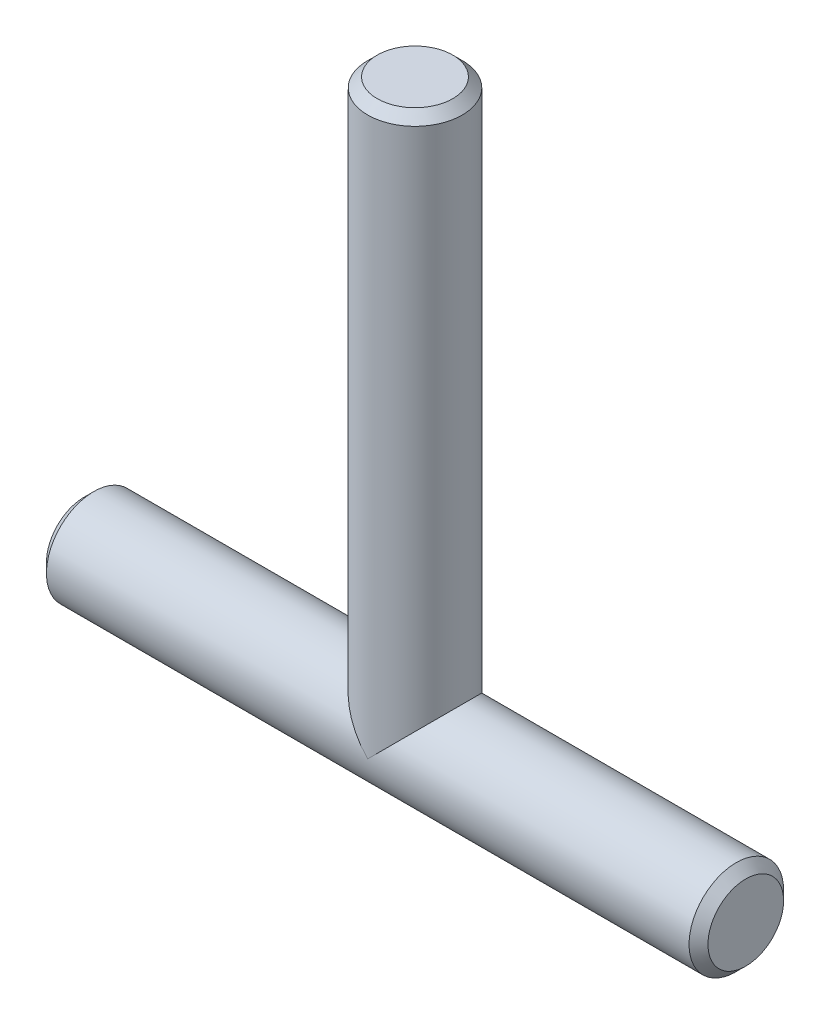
SolidWorks part; units mm, degrees
ref_plane "Front Plane" through (0, 0, 0) normal (0, 0, 1) x (1, 0, 0)
ref_plane "Top Plane" through (0, 0, 0) normal (0, 1, 0) x (1, 0, 0)
ref_plane "Right Plane" through (0, 0, 0) normal (1, 0, 0) x (0, 0, -1)
sketch "Sketch1" plane through (0, 0, 0) normal (1, 0, 0) x (0, 0, -1)
  circle A0 centre (0, 0) radius 5
  dimension "D1" = 10
extrude "Boss-Extrude1" add sketch "Sketch1" along normal mid plane 70
sketch "Sketch2" plane through (0, 0, 0) normal (0, 1, 0) x (1, 0, 0)
  circle A0 centre (0, 0) radius 5
  dimension "D1" = 10
extrude "Boss-Extrude2" add sketch "Sketch2" along normal blind 60
chamfer "Chamfer1" distance 1 angle 45 3 edges at (0, 60, 5) (35, 0, -5) (-35, 0, -5)
